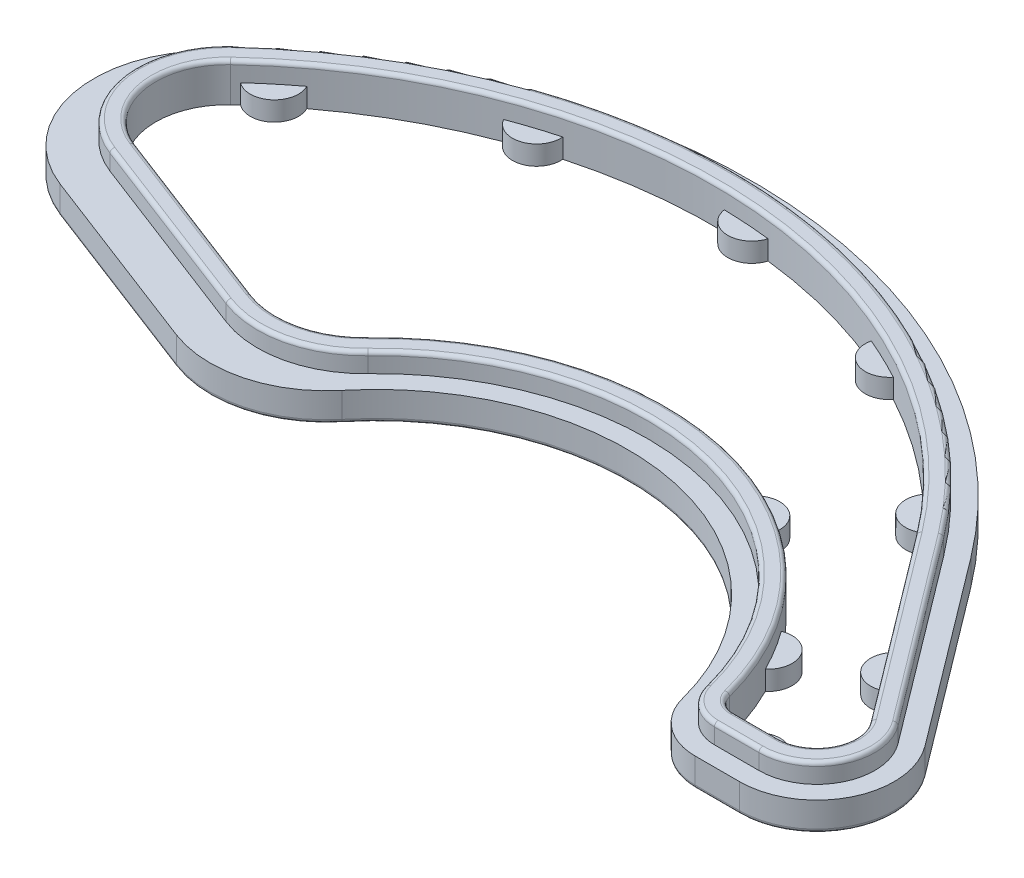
SolidWorks part; units mm, degrees
ref_plane "Front Plane" through (0, 0, 0) normal (0, 0, 1) x (1, 0, 0)
ref_plane "Top Plane" through (0, 0, 0) normal (0, 1, 0) x (1, 0, 0)
ref_plane "Right Plane" through (0, 0, 0) normal (1, 0, 0) x (0, 0, -1)
sketch "Schizzo28" plane through (0, 0, 9.5) normal (0, -1, 0) x (1, 0, 0)
  line L0 (-17.8027, -10.2118) -> (-8.0304, -6.4606)
  line L1 (0, 0) -> (22.5615, -17.0013) construction
  line L2 (22.5615, -17.0013) -> (29.7911, -7.4073)
  line L3 (26.5965, -1) -> (24.2919, -1)
  line L4 (-16.7276, -13.0126) -> (-6.9553, -9.2613)
  line L5 (26.5965, -4) -> (24.2919, -4)
  line L6 (20.1655, -15.1958) -> (27.3952, -5.6018)
  line L7 (0, 0) -> (8.8, 0) construction
  line L8 (-8.0304, -6.4606) -> (8.8, 0) construction
  line L9 (0, 0) -> (0, 5.6175) construction
  arc A0 (-1.2443, -8.253) -> (21.3872, -3.25) centre (8.8, 0) ccw
  arc A1 (-19.8734, -20.0776) -> (22.5615, -17.0013) centre (0, 0) ccw
  arc A2 (-1.2443, -8.253) -> (21.3872, -3.25) centre (8.8, 0) ccw construction
  arc A4 (-17.8027, -10.2118) -> (-19.8734, -20.0776) centre (-15.6525, -15.8133) ccw
  arc A5 (-1.2443, -8.253) -> (-8.0304, -6.4606) centre (-5.8802, -12.0621) ccw
  arc A6 (24.2919, -1) -> (21.3872, -3.25) centre (24.2919, -4) ccw
  arc A7 (29.7911, -7.4073) -> (26.5965, -1) centre (26.5965, -5) ccw
  arc A8 (-3.5622, -10.1575) -> (-6.9553, -9.2613) centre (-5.8802, -12.0621) ccw
  arc A9 (-3.5622, -10.1575) -> (24.2919, -4) centre (8.8, 0) ccw
  arc A10 (24.2919, -4) -> (24.2919, -4) centre (24.2919, -4) ccw
  arc A11 (27.3952, -5.6018) -> (26.5965, -4) centre (26.5965, -5) ccw
  arc A12 (-17.763, -17.9454) -> (20.1655, -15.1958) centre (0, 0) ccw
  arc A13 (-16.7276, -13.0126) -> (-17.763, -17.9454) centre (-15.6525, -15.8133) ccw
  dimension "D2" = 13
  dimension "D3" = 6
  dimension "D4" = 6
  dimension "D5" = 3
  dimension "D6" = 4
  dimension "D12" = 28.25
  dimension "D8" = 1
  dimension "D9" = 8.8
  dimension "D10" = 21
  dimension "D11" = 37
  dimension "D7" = 3
sketch "Schizzo30" plane through (0, 0, 0) normal (0, 1, 0) x (1, 0, 0)
  line L6 (-17.8027, 0.7118) -> (-8.0304, -3.0394)
  line L7 (24.2919, -8.5) -> (26.5965, -8.5)
  line L8 (29.7911, -2.0927) -> (22.5615, 7.5013)
  line L9 (-17.8027, 0.7118) -> (-8.0304, -3.0394)
  line L10 (24.2919, -8.5) -> (26.5965, -8.5)
  line L11 (29.7911, -2.0927) -> (22.5615, 7.5013)
  arc A12 (-8.0304, -3.0394) -> (-1.2443, -1.247) centre (-5.8802, 2.5621) ccw
  arc A13 (21.3872, -6.25) -> (-1.2443, -1.247) centre (8.8, -9.5) ccw
  arc A14 (21.3872, -6.25) -> (24.2919, -8.5) centre (24.2919, -5.5) ccw
  arc A15 (26.5965, -8.5) -> (29.7911, -2.0927) centre (26.5965, -4.5) ccw
  arc A16 (22.5615, 7.5013) -> (-19.8734, 10.5776) centre (0, -9.5) ccw
  arc A17 (-19.8734, 10.5776) -> (-17.8027, 0.7118) centre (-15.6525, 6.3133) ccw
  arc A18 (-8.0304, -3.0394) -> (-1.2443, -1.247) centre (-5.8802, 2.5621) ccw
  arc A19 (21.3872, -6.25) -> (-1.2443, -1.247) centre (8.8, -9.5) ccw
  arc A20 (21.3872, -6.25) -> (24.2919, -8.5) centre (24.2919, -5.5) ccw
  arc A21 (26.5965, -8.5) -> (29.7911, -2.0927) centre (26.5965, -4.5) ccw
  arc A22 (22.5615, 7.5013) -> (-19.8734, 10.5776) centre (0, -9.5) ccw
  arc A23 (-19.8734, 10.5776) -> (-17.8027, 0.7118) centre (-15.6525, 6.3133) ccw
  dimension "D1" = 0
extrude "Estrusione-Estrusione1" add sketch "Schizzo30" along normal blind 1
sketch "Schizzo31" plane through (0, 0, 0) normal (0, 1, 0) x (1, 0, 0)
  line L16 (-16.7276, 3.5126) -> (-6.9553, -0.2387)
  line L19 (-17.086, 2.579) -> (-7.3136, -1.1723)
  line L20 (24.2919, -6.5) -> (26.5965, -6.5)
  line L21 (28.1938, -3.2964) -> (20.9642, 6.2976)
  line L23 (24.2919, -6.5) -> (26.5965, -6.5)
  line L24 (28.1938, -3.2964) -> (20.9642, 6.2976)
  arc A0 (-16.7276, 3.5126) -> (-17.9296, 9.6727) centre (-15.4009, 6.9688) cw
  arc A1 (-6.9553, -0.2387) -> (-2.0443, 0.8635) centre (-5.3277, 4.0013) ccw
  arc A39 (-7.3136, -1.1723) -> (-2.7896, 0.0227) centre (-5.8802, 2.5621) ccw
  arc A40 (23.3237, -5.75) -> (-2.7896, 0.0227) centre (8.8, -9.5) ccw
  arc A41 (23.3237, -5.75) -> (24.2919, -6.5) centre (24.2919, -5.5) ccw
  arc A42 (26.5965, -6.5) -> (28.1938, -3.2964) centre (26.5965, -4.5) ccw
  arc A43 (20.9642, 6.2976) -> (-18.4665, 9.1562) centre (0, -9.5) ccw
  arc A44 (-18.4665, 9.1562) -> (-17.086, 2.579) centre (-15.6525, 6.3133) ccw
  arc A46 (23.3237, -5.75) -> (-2.0443, 0.8635) centre (8.8, -9.5) ccw
  arc A47 (23.3237, -5.75) -> (24.2919, -6.5) centre (24.2919, -5.5) ccw
  arc A48 (26.5965, -6.5) -> (28.1938, -3.2964) centre (26.5965, -4.5) ccw
  arc A49 (20.9642, 6.2976) -> (-17.9296, 9.6727) centre (0, -9.5) ccw
  dimension "D1" = 2
extrude "Taglio-Estrusione2" cut sketch "Schizzo31" along normal through all
sketch "Schizzo32" plane through (0, 0, 0) normal (0, 1, 0) x (1, 0, 0)
  line L0 (26.5965, -5.5) -> (24.2919, -5.5) construction
  line L1 (20.1655, 5.6958) -> (27.3952, -3.8982) construction
  line L2 (-1.0266, 1.5) -> (6.6752, 5.0962) construction
  line L3 (6.6752, 5.0962) -> (15.0826, 3.8451) construction
  line L4 (15.0826, 3.8451) -> (21.4037, -1.8377) construction
  line L5 (-16.9013, 10.9107) -> (-8.1341, 15.7208) construction
  line L6 (-8.1341, 15.7208) -> (1.7914, 16.9394) construction
  line L7 (1.7914, 16.9394) -> (11.4618, 14.393) construction
  line L8 (11.4618, 14.393) -> (19.5, 8.4444) construction
  line L9 (0, -9.5) -> (8.8, -9.5) construction
  circle A0 centre (-1.0266, 1.5) radius 1.25
  arc A1 (24.2919, -5.5) -> (-3.5622, 0.6575) centre (8.8, -9.5) ccw construction
  circle A2 centre (6.6752, 5.0962) radius 1.25
  circle A3 centre (15.0826, 3.8451) radius 1.25
  circle A4 centre (21.4037, -1.8377) radius 1.25
  circle A5 centre (25.7, -6.75) radius 1.25
  circle A6 centre (25.7, 0.4284) radius 1.25
  circle A7 centre (19.5, 8.4444) radius 1.25
  circle A8 centre (11.4618, 14.393) radius 1.25
  circle A9 centre (1.7914, 16.9394) radius 1.25
  circle A10 centre (-8.1341, 15.7208) radius 1.25
  circle A11 centre (-16.9013, 10.9107) radius 1.25
  arc A12 (20.1655, 5.6958) -> (-17.763, 8.4454) centre (0, -9.5) ccw construction
  dimension "D1" = 2.5
  dimension "D2" = 2.5
  dimension "D3" = 2.5
  dimension "D4" = 2.5
  dimension "D5" = 2.5
  dimension "D6" = 2.5
  dimension "D7" = 2.5
  dimension "D8" = 2.5
  dimension "D9" = 2.5
  dimension "D10" = 2.5
  dimension "D11" = 2.5
  dimension "D12" = 8.5
  dimension "D13" = 8.5
  dimension "D14" = 8.5
  dimension "D15" = 10
  dimension "D16" = 10
  dimension "D17" = 10
  dimension "D18" = 10
  dimension "D19" = 11
  dimension "D20" = 25.7
  dimension "D21" = 25.7
  dimension "D22" = 19.5
extrude "Estrusione-Estrusione2" add sketch "Schizzo32" along normal blind 1
sketch "Schizzo33" plane through (0, 0, 0) normal (0, 1, 0) x (1, 0, 0)
  line L22 (24.2919, -7.5) -> (26.5965, -7.5)
  line L23 (28.9924, -2.6946) -> (21.7628, 6.8995)
  line L24 (-17.4444, 1.6454) -> (-7.672, -2.1058)
  line L25 (24.2919, -7.5) -> (26.5965, -7.5)
  line L26 (28.9924, -2.6946) -> (21.7628, 6.8995)
  line L27 (-17.4444, 1.6454) -> (-7.672, -2.1058)
  line L47 (24.2919, -8.5) -> (26.5965, -8.5)
  line L48 (29.7911, -2.0927) -> (22.5615, 7.5013)
  line L49 (-17.8027, 0.7118) -> (-8.0304, -3.0394)
  line L50 (24.2919, -8.5) -> (26.5965, -8.5)
  line L51 (29.7911, -2.0927) -> (22.5615, 7.5013)
  line L52 (-17.8027, 0.7118) -> (-8.0304, -3.0394)
  arc A32 (-7.672, -2.1058) -> (-2.017, -0.6122) centre (-5.8802, 2.5621) ccw
  arc A33 (22.3554, -6) -> (-2.017, -0.6122) centre (8.8, -9.5) ccw
  arc A34 (22.3554, -6) -> (24.2919, -7.5) centre (24.2919, -5.5) ccw
  arc A35 (26.5965, -7.5) -> (28.9924, -2.6946) centre (26.5965, -4.5) ccw
  arc A36 (21.7628, 6.8995) -> (-19.1699, 9.8669) centre (0, -9.5) ccw
  arc A37 (-19.1699, 9.8669) -> (-17.4444, 1.6454) centre (-15.6525, 6.3133) ccw
  arc A38 (-7.672, -2.1058) -> (-2.017, -0.6122) centre (-5.8802, 2.5621) ccw
  arc A39 (22.3554, -6) -> (-2.017, -0.6122) centre (8.8, -9.5) ccw
  arc A40 (22.3554, -6) -> (24.2919, -7.5) centre (24.2919, -5.5) ccw
  arc A41 (26.5965, -7.5) -> (28.9924, -2.6946) centre (26.5965, -4.5) ccw
  arc A42 (21.7628, 6.8995) -> (-19.1699, 9.8669) centre (0, -9.5) ccw
  arc A43 (-19.1699, 9.8669) -> (-17.4444, 1.6454) centre (-15.6525, 6.3133) ccw
  arc A70 (-8.0304, -3.0394) -> (-1.2443, -1.247) centre (-5.8802, 2.5621) ccw
  arc A71 (21.3872, -6.25) -> (-1.2443, -1.247) centre (8.8, -9.5) ccw
  arc A72 (21.3872, -6.25) -> (24.2919, -8.5) centre (24.2919, -5.5) ccw
  arc A73 (26.5965, -8.5) -> (29.7911, -2.0927) centre (26.5965, -4.5) ccw
  arc A74 (22.5615, 7.5013) -> (-19.8734, 10.5776) centre (0, -9.5) ccw
  arc A75 (-19.8734, 10.5776) -> (-17.8027, 0.7118) centre (-15.6525, 6.3133) ccw
  arc A76 (-8.0304, -3.0394) -> (-1.2443, -1.247) centre (-5.8802, 2.5621) ccw
  arc A77 (21.3872, -6.25) -> (-1.2443, -1.247) centre (8.8, -9.5) ccw
  arc A78 (21.3872, -6.25) -> (24.2919, -8.5) centre (24.2919, -5.5) ccw
  arc A79 (26.5965, -8.5) -> (29.7911, -2.0927) centre (26.5965, -4.5) ccw
  arc A80 (22.5615, 7.5013) -> (-19.8734, 10.5776) centre (0, -9.5) ccw
  arc A81 (-19.8734, 10.5776) -> (-17.8027, 0.7118) centre (-15.6525, 6.3133) ccw
  dimension "D1" = 1
  dimension "D2" = 0
extrude "Estrusione-Estrusione3" add sketch "Schizzo33" against normal blind 0.5
sketch "Schizzo34" plane through (0, 0, 0) normal (0, 1, 0) x (1, 0, 0)
  line L19 (24.2919, -7.5) -> (26.5965, -7.5)
  line L20 (28.9924, -2.6946) -> (21.7628, 6.8995)
  line L21 (-17.086, 2.579) -> (-7.3136, -1.1723)
  line L22 (24.2919, -7.5) -> (26.5965, -7.5)
  line L23 (28.9924, -2.6946) -> (21.7628, 6.8995)
  line L24 (-17.086, 2.579) -> (-7.3136, -1.1723)
  line L41 (24.2919, -6.5) -> (26.5965, -6.5)
  line L42 (28.1938, -3.2964) -> (20.9642, 6.2976)
  line L43 (-16.7276, 3.5126) -> (-6.9553, -0.2387)
  line L44 (24.2919, -6.5) -> (26.5965, -6.5)
  line L45 (28.1938, -3.2964) -> (20.9642, 6.2976)
  line L46 (-16.7276, 3.5126) -> (-6.9553, -0.2387)
  arc A35 (22.3554, -6) -> (-1.3213, 0.1726) centre (8.8, -9.5) ccw
  arc A36 (22.3554, -6) -> (24.2919, -7.5) centre (24.2919, -5.5) ccw
  arc A37 (26.5965, -7.5) -> (28.9924, -2.6946) centre (26.5965, -4.5) ccw
  arc A38 (21.7628, 6.8995) -> (-18.6126, 10.4031) centre (0, -9.5) ccw
  arc A39 (-7.3136, -1.1723) -> (-1.3213, 0.1726) centre (-5.3277, 4.0013) ccw
  arc A40 (-18.6126, 10.4031) -> (-17.086, 2.579) centre (-15.4009, 6.9688) ccw
  arc A41 (22.3554, -6) -> (-1.3213, 0.1726) centre (8.8, -9.5) ccw
  arc A42 (22.3554, -6) -> (24.2919, -7.5) centre (24.2919, -5.5) ccw
  arc A43 (26.5965, -7.5) -> (28.9924, -2.6946) centre (26.5965, -4.5) ccw
  arc A44 (21.7628, 6.8995) -> (-18.6126, 10.4031) centre (0, -9.5) ccw
  arc A45 (-7.3136, -1.1723) -> (-1.3213, 0.1726) centre (-5.3277, 4.0013) ccw
  arc A46 (-18.6126, 10.4031) -> (-17.086, 2.579) centre (-15.4009, 6.9688) ccw
  arc A76 (23.3237, -5.75) -> (-2.0443, 0.8635) centre (8.8, -9.5) ccw
  arc A77 (23.3237, -5.75) -> (24.2919, -6.5) centre (24.2919, -5.5) ccw
  arc A78 (26.5965, -6.5) -> (28.1938, -3.2964) centre (26.5965, -4.5) ccw
  arc A79 (20.9642, 6.2976) -> (-17.9296, 9.6727) centre (0, -9.5) ccw
  arc A80 (-17.9296, 9.6727) -> (-16.7276, 3.5126) centre (-15.4009, 6.9688) ccw
  arc A81 (-6.9553, -0.2387) -> (-2.0443, 0.8635) centre (-5.3277, 4.0013) ccw
  arc A82 (23.3237, -5.75) -> (-2.0443, 0.8635) centre (8.8, -9.5) ccw
  arc A83 (23.3237, -5.75) -> (24.2919, -6.5) centre (24.2919, -5.5) ccw
  arc A84 (26.5965, -6.5) -> (28.1938, -3.2964) centre (26.5965, -4.5) ccw
  arc A85 (20.9642, 6.2976) -> (-17.9296, 9.6727) centre (0, -9.5) ccw
  arc A86 (-17.9296, 9.6727) -> (-16.7276, 3.5126) centre (-15.4009, 6.9688) ccw
  arc A87 (-6.9553, -0.2387) -> (-2.0443, 0.8635) centre (-5.3277, 4.0013) ccw
  dimension "D1" = 1
  dimension "D2" = 0
extrude "Estrusione-Estrusione4" add sketch "Schizzo34" along normal blind 2
fillet "Raccordo1" radius 0.2 18 edges at (-21.5246, -0.5, -5.0808) (2.0426, -0.5, -18.6761) (26.1763, -0.5, -2.7043) (30.1763, -0.5, 6.2848) (25.4442, -0.5, 8.5) (22.4548, -0.5, 7.8717) (11.6061, -0.5, -3.1935) (-4.3479, -0.5, 3.239) (-20.5459, -0.5, -5.2863) (1.9703, -0.5, -17.6787) (25.3776, -0.5, -2.1025) (29.2813, -0.5, 5.8386) (25.4442, -0.5, 7.5) (23.0672, -0.5, 7.0811) (11.8219, -0.5, -4.17) (-4.6033, -0.5, 2.2722) (-12.9165, -0.5, 1.1638) (-12.5582, -0.5, 0.2302)
fillet "Raccordo2" radius 0.2 18 edges at (24.579, 2, -1.5006) (28.3864, 2, 5.3924) (25.4442, 2, 6.5) (23.6796, 2, 6.2906) (12.5841, 2, -5.0149) (-4.3331, 2, 0.4301) (-11.8414, 2, -1.6369) (-19.0345, 2, -6.2598) (25.3776, 2, -2.1025) (29.2813, 2, 5.8386) (25.4442, 2, 7.5) (23.0672, 2, 7.0811) (12.3318, 2, -4.0472) (-4.1141, 2, 1.4058) (-12.1998, 2, -0.7034) (-20.016, 2, -6.0683) (2.2694, 2, -16.6517) (2.3558, 2, -17.648)
ref_plane "Piano di specchio" through (0, 0, 9.5) normal (0, 0, 1) x (1, 0, 0)
